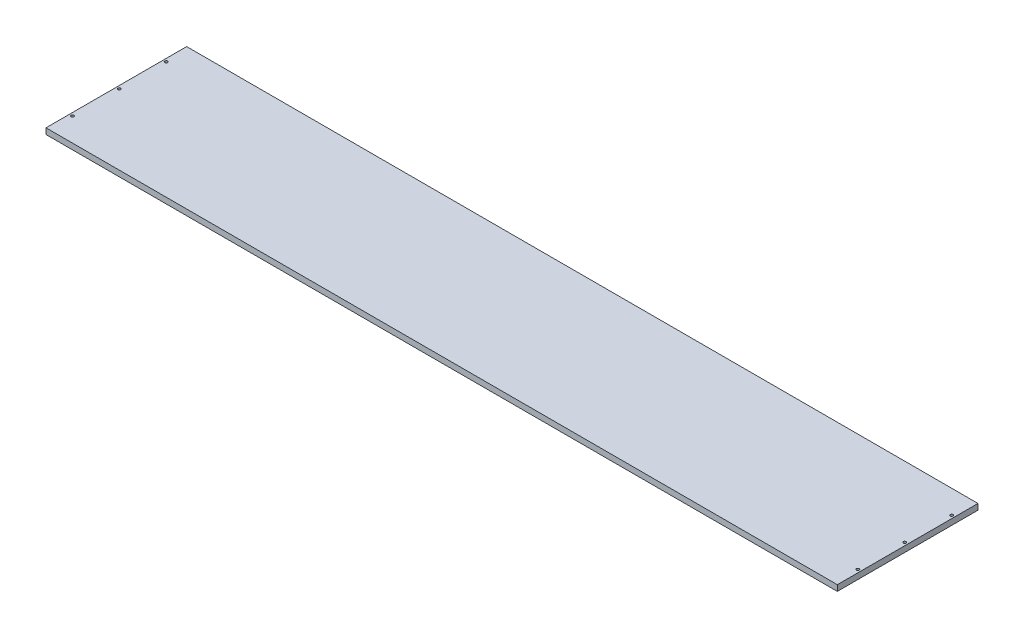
SolidWorks part; units mm, degrees
ref_plane "Front Plane" through (0, 0, 0) normal (0, 0, 1) x (1, 0, 0)
ref_plane "Top Plane" through (0, 0, 0) normal (0, 1, 0) x (1, 0, 0)
ref_plane "Right Plane" through (0, 0, 0) normal (1, 0, 0) x (0, 0, -1)
sketch "Sketch1" plane through (0, 0, 0) normal (0, 1, 0) x (1, 0, 0)
  line L1 (-428.625, -76.2) -> (428.625, -76.2)
  line L2 (-428.625, -76.2) -> (-428.625, 76.2)
  line L3 (-428.625, 76.2) -> (428.625, 76.2)
  line L4 (428.625, -76.2) -> (428.625, 76.2)
  line L5 (-428.625, -76.2) -> (428.625, 76.2) construction
  line L6 (-428.625, 76.2) -> (428.625, -76.2) construction
  point P0 (0, 0)
extrude "Boss-Extrude1" add sketch "Sketch1" along normal blind 6.35
hole_wizard "#31 (0.12) Diameter Hole1" positions "Sketch4" profile "Sketch5" hole size "#31" standard "ANSI Inch"
sketch "Sketch4" plane through (0, 6.35, 0) normal (0, 1, 0) x (1, 0, 0)
  line L0 (428.625, -76.2) -> (428.625, 76.2) construction
  line L1 (-428.625, 76.2) -> (-428.625, -76.2) construction
  line L2 (428.625, 76.2) -> (-428.625, 76.2) construction
  point P0 (425.45, 0)
  point P2 (425.45, 50.8)
  point P4 (425.45, -50.8)
  point P6 (-425.45, 0)
  point P8 (-425.45, -50.8)
  point P10 (-425.45, 50.8)
  dimension "D1" = 50.8
  dimension "D2" = 50.8
  dimension "D3" = 3.175
  dimension "D4" = 50.8
  dimension "D5" = 50.8
  dimension "D6" = 3.175
  dimension "D7" = 76.2
  dimension "D8" = 76.2
sketch "Sketch5" plane through (425.45, 6.35, 0) normal (1, 0, 0) x (0, 0, 1)
  line L0 (0, 0) -> (0, 6.35)
  line L1 (0, 6.35) -> (1.524, 6.35)
  line L2 (1.524, 6.35) -> (1.524, 0)
  line L5 (1.524, 0) -> (0, 0)
  line L11 (0, -6.35) -> (0, 107.95) construction
  dimension "Thru Hole Dia." = 3.048
  dimension "Thru Hole Depth" = 6.35
